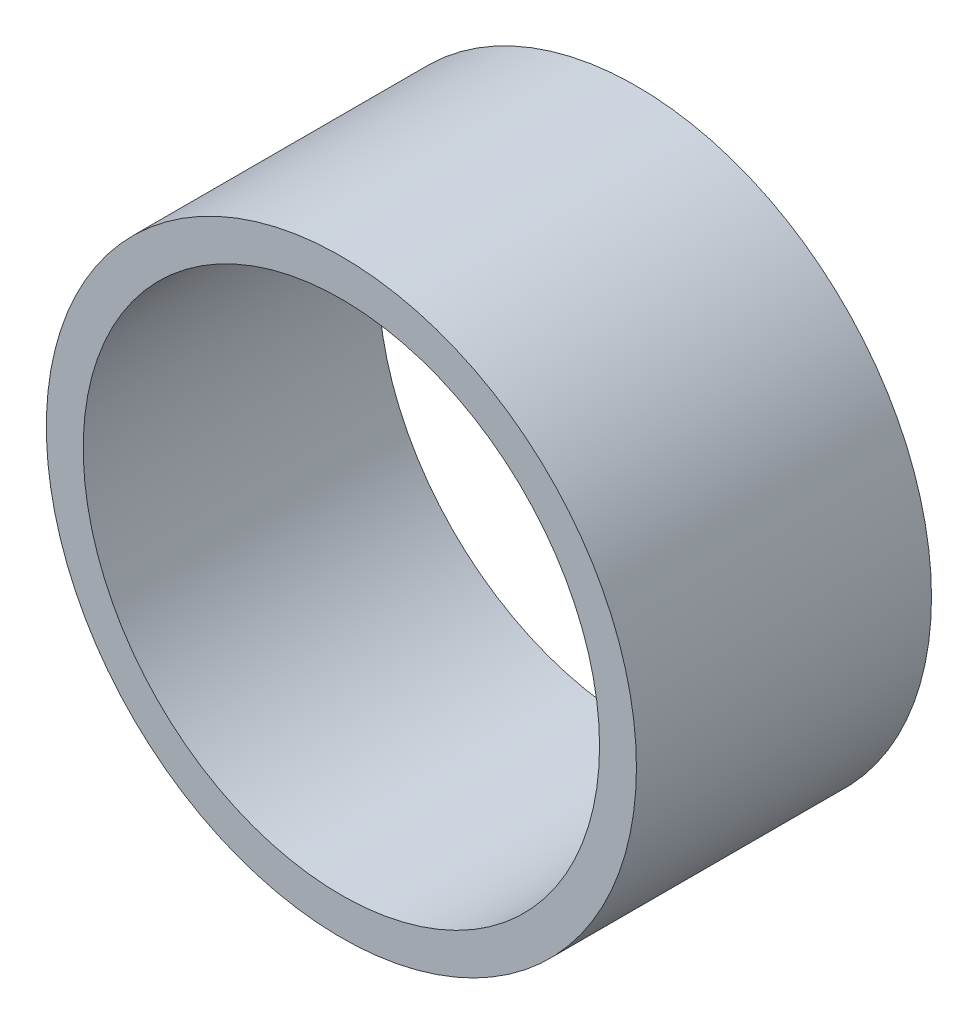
SolidWorks part; units mm, degrees
ref_plane "Front Plane" through (0, 0, 0) normal (0, 0, 1) x (1, 0, 0)
ref_plane "Top Plane" through (0, 0, 0) normal (0, 1, 0) x (1, 0, 0)
ref_plane "Right Plane" through (0, 0, 0) normal (1, 0, 0) x (0, 0, -1)
sketch "Sketch1" plane through (0, 0, 0) normal (0, 0, 1) x (1, 0, 0)
  circle A0 centre (0, 0) radius 50.8
  circle A1 centre (0, 0) radius 44.45
  dimension "D1" = 101.6
  dimension "D2" = 88.9
extrude "Extrude1" add sketch "Sketch1" along normal mid plane 50.8
